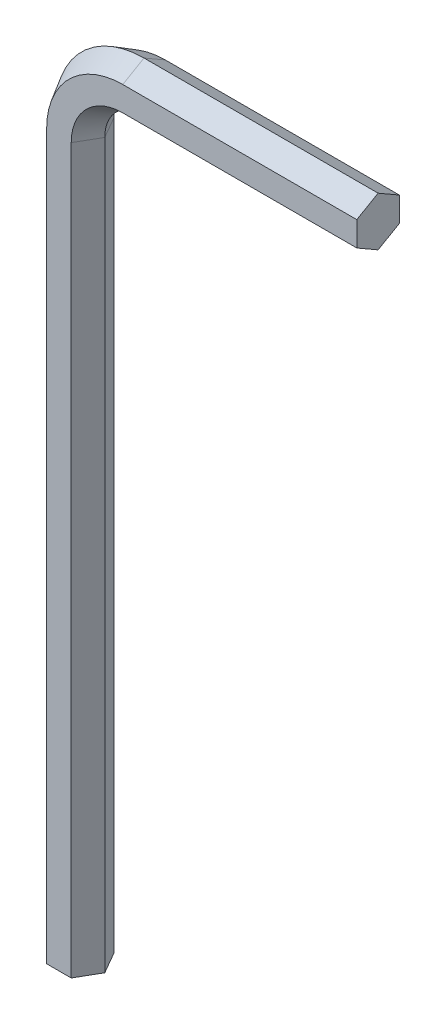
SolidWorks part; units mm, degrees
ref_plane "Plan de face" through (0, 0, 0) normal (0, 0, 1) x (1, 0, 0)
ref_plane "Plan de dessus" through (0, 0, 0) normal (0, 1, 0) x (1, 0, 0)
ref_plane "Plan de droite" through (0, 0, 0) normal (1, 0, 0) x (0, 0, -1)
sketch "Esquisse1" plane through (0, 0, 0) normal (0, 1, 0) x (1, 0, 0)
  line L1 (2.3094, 0) -> (1.1547, 2)
  line L2 (1.1547, 2) -> (-1.1547, 2)
  line L3 (-1.1547, 2) -> (-2.3094, 0)
  line L4 (-2.3094, 0) -> (-1.1547, -2)
  line L5 (-1.1547, -2) -> (1.1547, -2)
  line L6 (1.1547, -2) -> (2.3094, 0)
  circle A0 centre (0, 0) radius 2 construction
  dimension "D1" = 4
sketch "Esquisse2" plane through (0, 0, 0) normal (0, 0, 1) x (1, 0, 0)
  line L0 (0, 0) -> (0, 68)
  line L1 (6, 74) -> (28, 74)
  arc A0 (0, 68) -> (6, 74) centre (6, 68) cw
  dimension "D3" = 6
  dimension "D1" = 28
  dimension "D2" = 74
sweep "Balayage1" add profiles "Esquisse1" path "Esquisse2"
